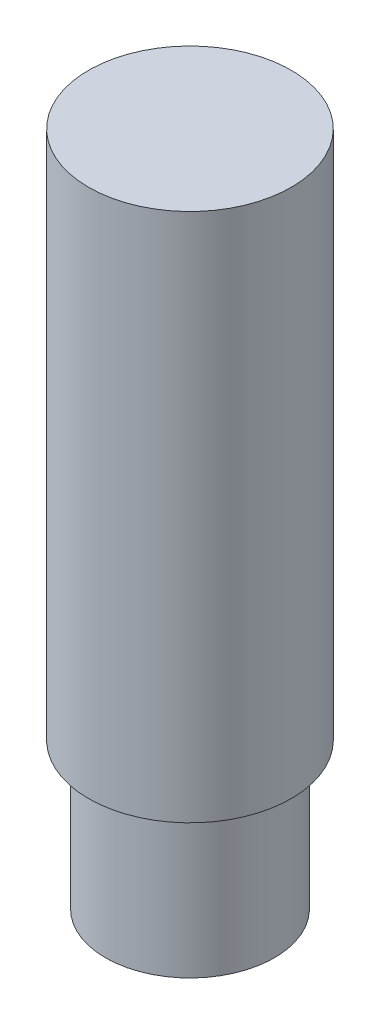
SolidWorks part; units mm, degrees
ref_plane "Front" through (0, 0, 0) normal (0, 0, 1) x (1, 0, 0)
ref_plane "Top" through (0, 0, 0) normal (0, 1, 0) x (1, 0, 0)
ref_plane "Right" through (0, 0, 0) normal (1, 0, 0) x (0, 0, -1)
sketch "Sketch1" plane through (0, 0, 0) normal (0, 1, 0) x (1, 0, 0)
  circle A0 centre (0, 0) radius 1.905
  dimension "D1" = 3.81
extrude "Extrude1" add sketch "Sketch1" along normal mid plane 15.24
sketch "Sketch2" plane through (0, 7.62, 0) normal (0, 1, 0) x (-1, 0, 0)
  circle A2 centre (0, 0) radius 2.286
  circle A3 centre (0, 0) radius 2.286
  dimension "D1" = 0.381
extrude "Extrude2" add sketch "Sketch2" against normal offset from surface (11.94 mm away) 3.3
